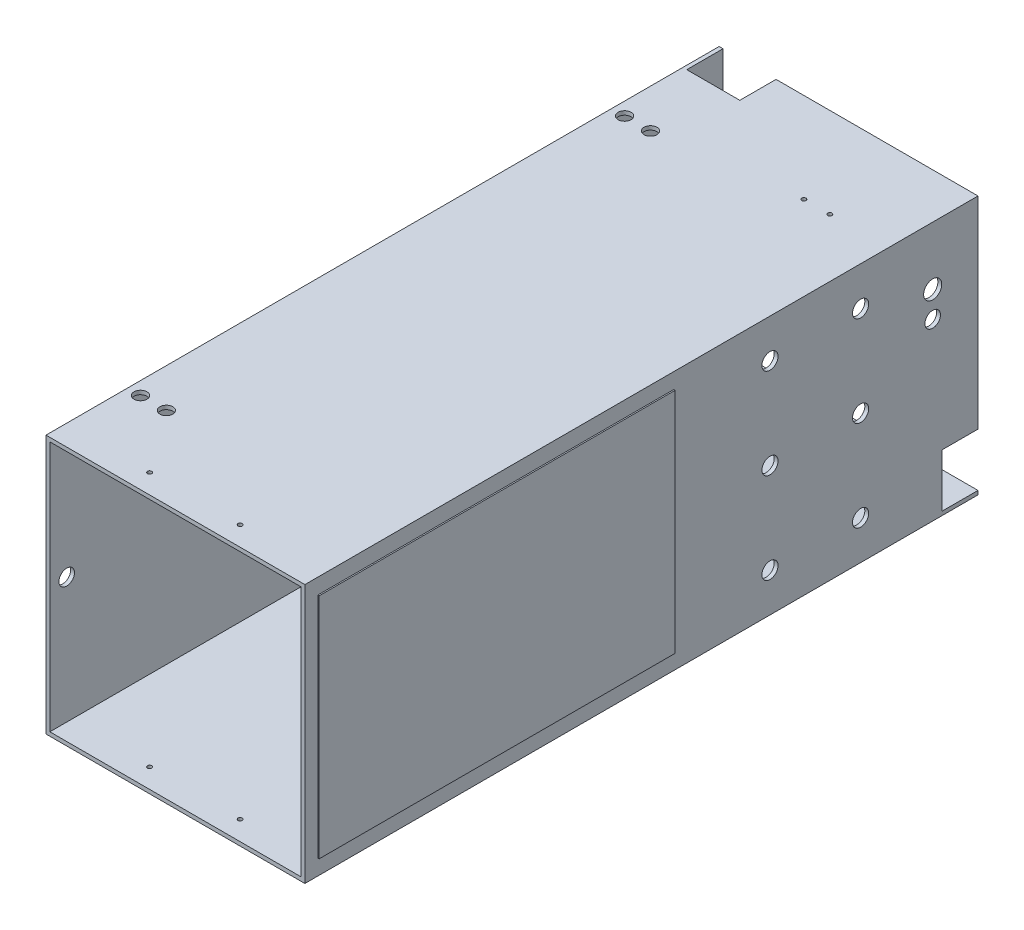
SolidWorks part; units mm, degrees
ref_plane "Plan de face" through (0, 0, 0) normal (0, 0, 1) x (1, 0, 0)
ref_plane "Plan de dessus" through (0, 0, 0) normal (0, 1, 0) x (1, 0, 0)
ref_plane "Plan de droite" through (0, 0, 0) normal (1, 0, 0) x (0, 0, -1)
sketch "Esquisse1" plane through (0, 0, 0) normal (0, 0, 1) x (1, 0, 0)
  line L0 (3, 3) -> (3, 197)
  line L1 (0, 0) -> (200, 0)
  line L2 (0, 0) -> (0, 200)
  line L3 (0, 200) -> (200, 200)
  line L4 (200, 0) -> (200, 200)
  line L5 (3, 197) -> (197, 197)
  line L6 (197, 3) -> (197, 197)
  line L7 (3, 3) -> (197, 3)
  dimension "D1" = 200
  dimension "D2" = 200
  dimension "D3" = 3
extrude "Extrusion1" add sketch "Esquisse1" along normal blind 520
sketch "Esquisse2" plane through (200, 0, 0) normal (1, 0, 0) x (0, 0, -1)
  line L0 (0, 0) -> (0, 200) construction
  line L1 (0, 44) -> (-28, 44)
  line L2 (0, 44) -> (0, 3)
  line L3 (0, 3) -> (-28, 3)
  line L4 (-28, 44) -> (-28, 3)
  line L5 (-520, 200) -> (0, 200) construction
  line L6 (-520, 3) -> (0, 3) construction
  line L7 (-520, 0) -> (0, 0) construction
  line L8 (-505, 20) -> (-240, 20)
  line L9 (-505, 20) -> (-505, 180)
  line L10 (-505, 180) -> (-240, 180)
  line L11 (-240, 20) -> (-240, 180)
  line L12 (-520, 0) -> (-520, 200) construction
  circle A0 centre (-35, 155) radius 7
  circle A1 centre (-35, 135) radius 6
  circle A12 centre (-90.7, 170) radius 6.25
  circle A13 centre (-160.7, 170) radius 6.25
  circle A14 centre (-90.7, 100) radius 6.25
  circle A15 centre (-160.7, 100) radius 6.25
  circle A16 centre (-90.7, 30) radius 6.25
  circle A17 centre (-160.7, 30) radius 6.25
  dimension "D1" = 20
  dimension "D2" = 12
  dimension "D3" = 14
  dimension "D4" = 35
  dimension "D5" = 45
  dimension "D6" = 90.7
  dimension "D7" = 70
  dimension "D8" = 70
  dimension "D10" = 12.5
  dimension "D11" = 12.5
  dimension "D12" = 12.5
  dimension "D13" = 70
  dimension "D14" = 12.5
  dimension "D15" = 12.5
  dimension "D16" = 12.5
  dimension "D9" = 100
  dimension "D17" = 28
  dimension "D18" = 41
  dimension "D19" = 160
  dimension "D20" = 265
  dimension "D21" = 20
  dimension "D22" = 15
extrude "Enlèv. mat.-Extru.1" cut sketch "Esquisse2" against normal up to next
hole_wizard "Trou taraudé M41" positions "Esquisse3D1" profile "Esquisse4" tap size "M4" standard "ISO"
sketch3d "Esquisse3D1"
  line L0 (200, 20, 505) -> (200, 20, 240) construction
  line L1 (200, 180, 505) -> (200, 20, 505) construction
  line L2 (200, 180, 240) -> (200, 180, 505) construction
  point P0 (200, 17, 500)
  point P7 (200, 183, 500)
  dimension "D1" = 3
  dimension "D2" = 5
  dimension "D3" = 3
sketch "Esquisse4" plane through (200, 17, 500) normal (0, 1, 0) x (0, 0, -1)
  line L0 (0, 0) -> (0, 200)
  line L1 (0, 200) -> (1.65, 200)
  line L2 (1.65, 200) -> (1.65, 0)
  line L5 (1.65, 0) -> (0, 0)
  line L11 (0, -6.35) -> (0, 107.95) construction
  dimension "Diamètre du trou pour taraudage jusqu'au prochain" = 3.3
  dimension "Profondeur du trou pour taraudage jusqu'au prochain" = 200
pattern_linear "Répétition linéaire1" count 2 spacing 125 along (0, 0, -1) of "Trou taraudé M41"
pattern_linear "Répétition linéaire2" count 2 spacing 255 along (0, 0, -1) of "Trou taraudé M41"
sketch "Esquisse5" plane through (0, 0, 0) normal (0, -1, 0) x (1, 0, 0)
  line L0 (0, 520) -> (200, 520) construction
  line L1 (200, 520) -> (200, 0) construction
  line L2 (0, 0) -> (200, 0) construction
  circle A0 centre (65, 505) radius 0.5
  circle A1 centre (135, 505) radius 0.5
  circle A2 centre (150, 380) radius 6
  circle A3 centre (170, 206.7) radius 7
  dimension "D1" = 1
  dimension "D2" = 1
  dimension "D3" = 70
  dimension "D4" = 15
  dimension "D6" = 140
  dimension "D7" = 50
  dimension "D8" = 12
  dimension "D9" = 206.7
  dimension "D10" = 30
  dimension "D11" = 14
  dimension "D5" = 65
extrude "Enlèv. mat.-Extru.2" cut sketch "Esquisse5" against normal up to next
sketch "Esquisse6" plane through (0, 200, 0) normal (0, 1, 0) x (1, 0, 0)
  line L0 (0, -520) -> (0, 0) construction
  line L1 (200, -520) -> (0, -520) construction
  line L8 (200, -520) -> (200, 0) construction
  line L9 (200, 0) -> (0, 0) construction
  line L10 (44, 0) -> (3, 0)
  line L11 (44, 0) -> (44, -28)
  line L12 (44, -28) -> (3, -28)
  line L13 (3, 0) -> (3, -28)
  line L14 (3, -520) -> (3, 0) construction
  circle A0 centre (135, -505) radius 0.5 construction
  circle A1 centre (135, -505) radius 0.5
  circle A2 centre (65, -505) radius 0.5 construction
  circle A3 centre (65, -505) radius 0.5
  circle A4 centre (10, -83) radius 5
  circle A5 centre (30, -83) radius 5
  circle A6 centre (10, -457) radius 5
  circle A7 centre (30, -457) radius 5
  circle A12 centre (155, -69.5) radius 0.5
  circle A13 centre (135, -69.5) radius 0.5
  dimension "D2" = 10
  dimension "D3" = 10
  dimension "D4" = 20
  dimension "D7" = 45
  dimension "D9" = 1
  dimension "D10" = 1
  dimension "D12" = 83
  dimension "D13" = 10
  dimension "D14" = 63
  dimension "D15" = 10
  dimension "D16" = 10
  dimension "D17" = 20
  dimension "D18" = 10
  dimension "D5" = 41
  dimension "D6" = 28
  dimension "D8" = 69.5
  dimension "D11" = 20
extrude "Enlèv. mat.-Extru.3" cut sketch "Esquisse6" against normal up to next
sketch "Esquisse7" plane through (0, 0, 0) normal (-1, 0, 0) x (0, 0, 1)
  line L0 (520, 200) -> (520, 0) construction
  line L1 (520, 200) -> (0, 200) construction
  line L2 (0, 200) -> (0, 0) construction
  circle A0 centre (507, 100) radius 6
  circle A1 centre (35, 135) radius 2.5
  dimension "D1" = 12
  dimension "D2" = 13
  dimension "D5" = 65
  dimension "D6" = 5
  dimension "D4" = 35
  dimension "D3" = 100
extrude "Enlèv. mat.-Extru.4" cut sketch "Esquisse7" against normal up to next
sketch "Esquisse8" plane through (200, 0, 0) normal (1, 0, 0) x (0, 0, -1)
  line L0 (-505, 180) -> (-505, 20) construction
  line L1 (-510, 12) -> (-235, 12)
  line L2 (-510, 12) -> (-510, 188)
  line L3 (-510, 188) -> (-235, 188)
  line L4 (-235, 12) -> (-235, 188)
  line L5 (-505, 20) -> (-240, 20) construction
  line L6 (-240, 180) -> (-505, 180) construction
  line L7 (-240, 20) -> (-240, 180) construction
  dimension "D1" = 5
  dimension "D2" = 8
  dimension "D3" = 8
  dimension "D4" = 5
extrude "Extrusion2" add sketch "Esquisse8" along normal blind 1
hole_wizard "Trou taraudé M42" positions "Esquisse3D2" profile "Esquisse9" tap size "M4" standard "ISO"
sketch3d "Esquisse3D2"
  line L0 (155, 197, 69.5) -> (155, 200, 69.5) construction
  line L1 (135, 197, 69.5) -> (135, 200, 69.5) construction
  line L2 (135, 197, 505) -> (135, 200, 505) construction
  line L3 (65, 197, 505) -> (65, 200, 505) construction
  line L4 (65, 3, 505) -> (65, 0, 505) construction
  line L5 (135, 3, 505) -> (135, 0, 505) construction
  point P0 (155, 200, 69.5)
  point P4 (135, 200, 69.5)
  point P8 (135, 200, 505)
  point P12 (65, 200, 505)
  point P16 (65, 3, 505)
  point P20 (135, 3, 505)
sketch "Esquisse9" plane through (155, 200, 69.5) normal (1, 0, 0) x (0, 0, 1)
  line L0 (0, 0) -> (0, 200)
  line L1 (0, 200) -> (1.65, 200)
  line L2 (1.65, 200) -> (1.65, 0)
  line L5 (1.65, 0) -> (0, 0)
  line L11 (0, -6.35) -> (0, 107.95) construction
  dimension "Diamètre du trou pour taraudage jusqu'au prochain" = 3.3
  dimension "Profondeur du trou pour taraudage jusqu'au prochain" = 200
